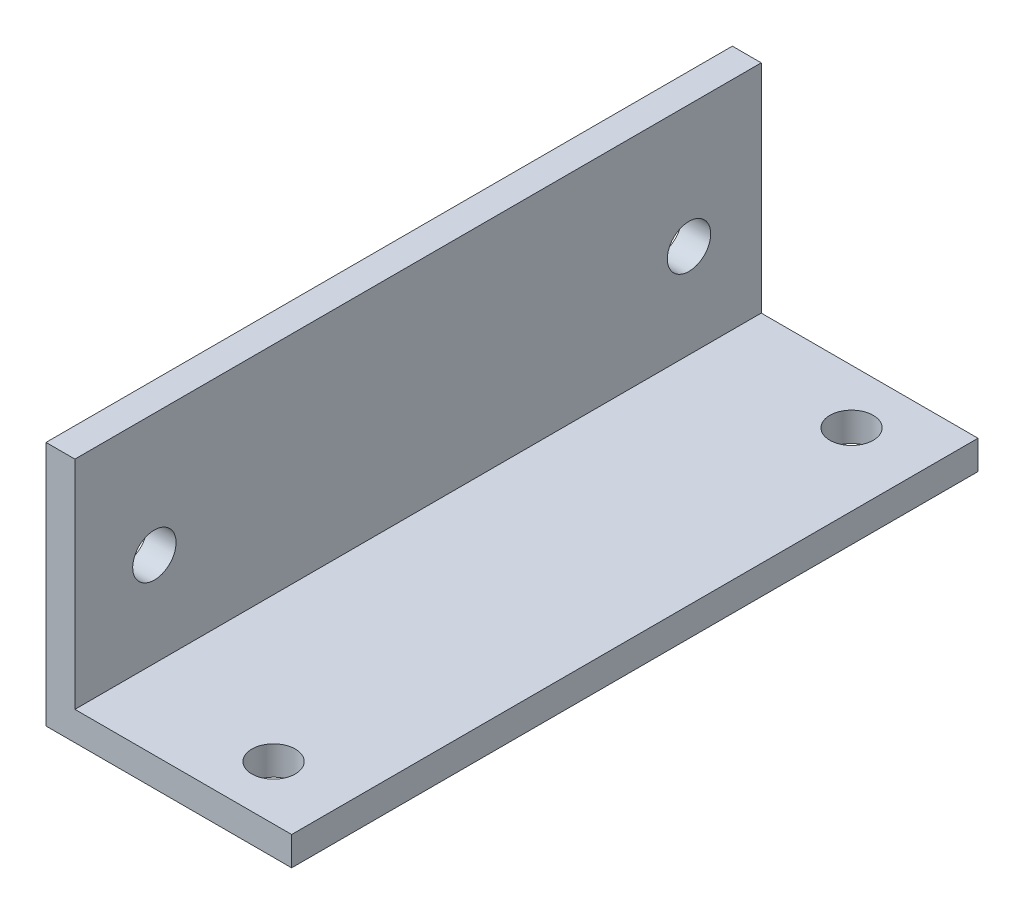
SolidWorks part; units mm, degrees
ref_plane "前视基准面" through (0, 0, 0) normal (0, 0, 1) x (1, 0, 0)
ref_plane "上视基准面" through (0, 0, 0) normal (0, 1, 0) x (1, 0, 0)
ref_plane "右视基准面" through (0, 0, 0) normal (1, 0, 0) x (0, 0, -1)
sketch "草图1" plane through (0, 0, 0) normal (0, 0, 1) x (1, 0, 0)
  line L0 (0, 17) -> (0, 0)
  line L1 (0, 0) -> (17, 0)
  line L2 (17, 0) -> (17, 2)
  line L3 (17, 2) -> (2, 2)
  line L4 (2, 2) -> (2, 17)
  line L5 (2, 17) -> (0, 17)
  dimension "D1" = 2
  dimension "D2" = 2
  dimension "D3" = 15
  dimension "D4" = 15
extrude "凸台-拉伸1" add sketch "草图1" along normal blind 125
sketch "草图3" plane through (0, 0, 0) normal (-1, 0, 0) x (0, 0, 1)
  line L0 (62.5, 17) -> (62.5, 0) construction
  line L1 (125, 17) -> (0, 17) construction
  line L2 (125, 0) -> (0, 0) construction
  line L3 (0, 17) -> (0, 0) construction
  circle A0 centre (5, 8.5) radius 1.5
  circle A1 centre (42, 8.5) radius 1.5
  circle A2 centre (83, 8.5) radius 1.5
  circle A3 centre (120, 8.5) radius 1.5
  dimension "D1" = 37
  dimension "D2" = 5
extrude "切除-拉伸3" cut sketch "草图3" against normal blind 30
sketch "草图5" plane through (0, 0, 0) normal (-1, 0, 0) x (0, 0, 1)
  line L0 (47.5, 17) -> (47.5, 0)
  line L1 (125, 0) -> (0, 0) construction
  line L2 (125, 17) -> (0, 17) construction
  line L4 (47.5, 0) -> (134.0436, 0)
  line L5 (134.0436, 0) -> (138.3356, 27.9539)
  line L6 (138.3356, 27.9539) -> (47.5, 17)
extrude "切除-拉伸4" cut sketch "草图5" against normal blind 74
sketch "草图6" plane through (0, 2, 0) normal (0, 1, 0) x (1, 0, 0)
  line L0 (17, -23.75) -> (0, -23.75) construction
  line L1 (17, -47.5) -> (17, 0) construction
  line L2 (0, -47.5) -> (0, 0) construction
  circle A1 centre (12, -3.75) radius 1.5
  circle A2 centre (12, -43.75) radius 1.5
  dimension "D1" = 20
  dimension "D2" = 5
extrude "切除-拉伸5" cut sketch "草图6" against normal blind 10
